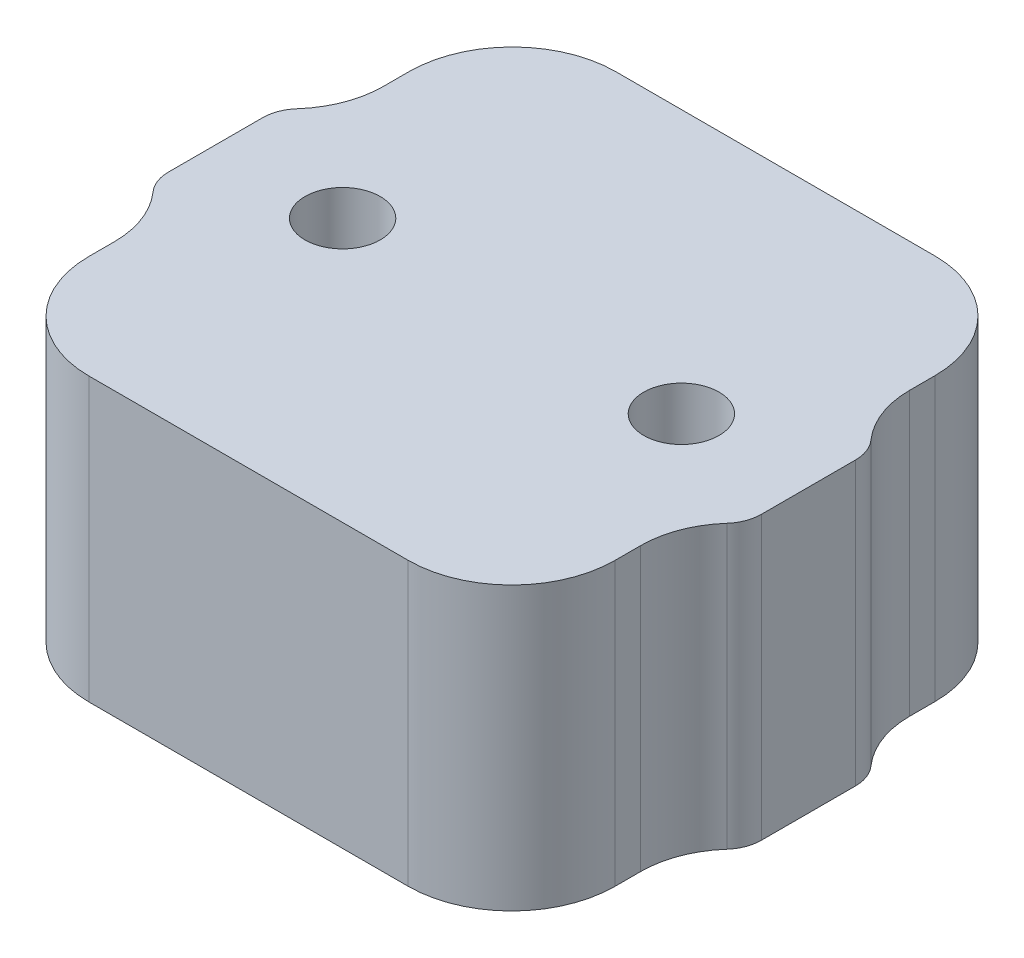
SolidWorks part; units mm, degrees
ref_plane "Front Plane" through (0, 0, 0) normal (0, 0, 1) x (1, 0, 0)
ref_plane "Top Plane" through (0, 0, 0) normal (0, 1, 0) x (1, 0, 0)
ref_plane "Right Plane" through (0, 0, 0) normal (1, 0, 0) x (0, 0, -1)
sketch "Sketch1" plane through (0, 0, 0) normal (0, 1, 0) x (1, 0, 0)
  line L0 (-37.2798, 16.8264) -> (-40.6722, 16.8264)
  line L1 (-36.1798, 15.7266) -> (-36.1797, 15.4564)
  line L2 (-35.826, 14.5264) -> (-35.826, 13.5264)
  line L3 (-38.976, 16.8264) -> (-38.976, 11.2264) construction
  line L4 (-35.826, 14.0264) -> (-42.126, 14.0264) construction
  line L5 (-42.126, 14.5264) -> (-42.126, 13.5264)
  line L6 (-41.7722, 15.7266) -> (-41.7723, 15.4564)
  line L7 (-36.1798, 12.3262) -> (-36.1797, 12.5964)
  line L8 (-37.2798, 11.2264) -> (-40.6722, 11.2264)
  line L9 (-41.7722, 12.3262) -> (-41.7723, 12.5964)
  arc A0 (-37.2798, 16.8264) -> (-36.1798, 15.7266) centre (-37.2798, 15.7264) cw
  arc A1 (-36.1797, 15.4564) -> (-35.9271, 14.7922) centre (-35.1797, 15.4566) ccw
  arc A2 (-35.9271, 14.7922) -> (-35.826, 14.5264) centre (-36.226, 14.5264) cw
  arc A3 (-42.0249, 14.7922) -> (-42.126, 14.5264) centre (-41.726, 14.5264) ccw
  arc A4 (-41.7723, 15.4564) -> (-42.0249, 14.7922) centre (-42.7723, 15.4566) cw
  arc A5 (-40.6722, 16.8264) -> (-41.7722, 15.7266) centre (-40.6722, 15.7264) ccw
  arc A6 (-35.9271, 13.2606) -> (-35.826, 13.5264) centre (-36.226, 13.5264) ccw
  arc A7 (-36.1797, 12.5964) -> (-35.9271, 13.2606) centre (-35.1797, 12.5962) cw
  arc A8 (-37.2798, 11.2264) -> (-36.1798, 12.3262) centre (-37.2798, 12.3264) ccw
  arc A9 (-40.6722, 11.2264) -> (-41.7722, 12.3262) centre (-40.6722, 12.3264) cw
  arc A10 (-41.7723, 12.5964) -> (-42.0249, 13.2606) centre (-42.7723, 12.5962) ccw
  arc A11 (-42.0249, 13.2606) -> (-42.126, 13.5264) centre (-41.726, 13.5264) cw
  dimension "D1" = 3.3924
extrude "Boss-Extrude1" add sketch "Sketch1" along normal blind 3
sketch "Sketch2" plane through (0, 3, 0) normal (0, 1, 0) x (1, 0, 0)
  line L0 (-42.126, 14.0264) -> (-35.826, 14.0264) construction
  line L1 (-42.126, 14.5264) -> (-42.126, 13.5264) construction
  line L2 (-35.826, 13.5264) -> (-35.826, 14.5264) construction
  line L3 (-38.976, 14.0264) -> (-38.976, 14.4365) construction
  circle A0 centre (-40.776, 14.0264) radius 0.4
  circle A1 centre (-37.176, 14.0264) radius 0.4
  dimension "D1" = 0.8
  dimension "D2" = 1.35
extrude "Cut-Extrude1" cut sketch "Sketch2" against normal through all
